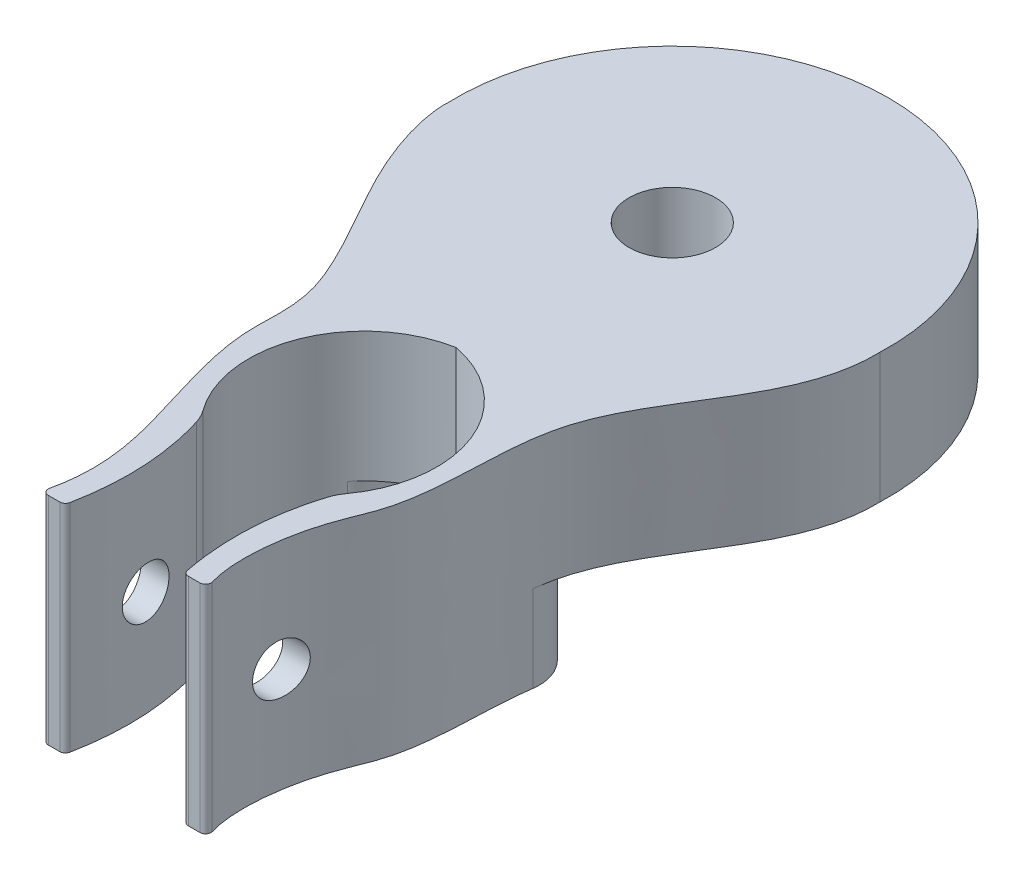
SolidWorks part; units mm, degrees
ref_plane "Front Plane" through (0, 0, 0) normal (0, 0, 1) x (1, 0, 0)
ref_plane "Top Plane" through (0, 0, 0) normal (0, 1, 0) x (1, 0, 0)
ref_plane "Right Plane" through (0, 0, 0) normal (1, 0, 0) x (0, 0, -1)
sketch "Sketch1" plane through (0, 0, 0) normal (0, 1, 0) x (1, 0, 0)
  line L0 (0, 12.7) -> (0, -18.5764) construction
  line L1 (-4.4511, -32.1986) -> (-3.776, -32.1986)
  line L2 (4.4511, -32.1986) -> (3.776, -32.1986)
  arc A0 (-12.6901, -0.502) -> (12.6901, -0.502) centre (0, 0) cw
  circle A1 centre (0, 0) radius 2.54
  arc A2 (-12.6901, -0.502) -> (12.6901, -0.502) centre (0, 0) ccw construction
  arc A3 (0, -12.7) -> (-4.2124, -23.3606) centre (1.256, -19.3588) ccw
  arc A4 (-4.2124, -23.3606) -> (-3.8349, -24.1124) centre (-6.2622, -24.8607) cw
  arc A5 (-3.4519, -31.9324) -> (-3.776, -32.1986) centre (-3.776, -31.8683) cw
  arc A6 (-4.7735, -31.7962) -> (-4.4511, -32.1986) centre (-4.4511, -31.8683) ccw
  arc A7 (4.7735, -31.7962) -> (4.4511, -32.1986) centre (4.4511, -31.8683) cw
  arc A8 (3.4519, -31.9324) -> (3.776, -32.1986) centre (3.776, -31.8683) ccw
  arc A9 (4.2124, -23.3606) -> (3.8349, -24.1124) centre (6.2622, -24.8607) ccw
  arc A10 (0, -12.7) -> (4.2124, -23.3606) centre (-1.256, -19.3588) cw
  spline S0 degree 3 poles (-12.6901, -0.502) (-12.7086, -0.5346) (-12.9445, -3.8187) (-6.4425, -13.8865) (-7.3603, -18.4592) (-5.2739, -24.7591) (-4.156, -29.0329) (-4.7735, -31.7962) knots 0 0 0 0 0.279659 0.433864 0.566787 0.759909 0.988954 0.988954 0.988954 0.988954
  spline S1 degree 3 poles (-3.8349, -24.1124) (-3.6668, -24.6575) (-3.0286, -27.202) (-3.0384, -29.8419) (-3.4519, -31.9324) knots 0.055076 0.055076 0.055076 0.055076 0.252507 0.96957 0.96957 0.96957 0.96957
  spline S2 degree 3 poles (3.8349, -24.1124) (3.6668, -24.6575) (3.0286, -27.202) (3.0384, -29.8419) (3.4519, -31.9324) knots 0.055076 0.055076 0.055076 0.055076 0.252507 0.96957 0.96957 0.96957 0.96957
  spline S3 degree 3 poles (12.6901, -0.502) (12.8342, -5.638) (5.4885, -11.2875) (7.0856, -20.9954) (4.5252, -26.6602) (4.2626, -30.148) (4.7735, -31.7962) knots 0 0 0 0 0.420411 0.703009 0.760968 1 1 1 1
  dimension "D1" = 12.7
  dimension "D2" = 5.08
  dimension "D3" = 2.54
  dimension "D4" = 0.3304
extrude "Boss-Extrude1" add sketch "Sketch1" along normal blind 12.7
ref_plane "Plane1" through (0, 5.08, 0) normal (0, 1, 0) x (1, 0, 0)
sketch "Sketch4" plane through (0, 5.08, 0) normal (0, 1, 0) x (1, 0, 0)
  circle A0 centre (0, 0) radius 12.827
  dimension "D1" = 25.654
extrude "Cut-Extrude4" cut sketch "Sketch4" against normal blind 5.08
fillet "Fillet5" radius 2.54 1 edges at (9.9596, 2.54, 8.0832)
fillet "Fillet6" radius 2.54 1 edges at (-10.2825, 2.54, 7.6682)
fillet "Fillet7" radius 2.54 2 edges at (-0.5103, 2.54, 12.8168) (0.5103, 2.54, 12.8168)
ref_plane "Plane4" through (7.62, 0, 0) normal (1, 0, 0) x (0, 0, -1)
hole_wizard "#4 Clearance Hole3" positions "Sketch12" profile "Sketch11" hole size "#4" standard "ANSI Inch"
sketch "Sketch12" plane through (7.62, 0, 0) normal (1, 0, 0) x (0, 0, -1)
  point P0 (-27.693, 6.1658)
sketch "Sketch11" plane through (7.62, 6.1658, 27.693) normal (0, 1, 0) x (0, 0, -1)
  line L0 (0, 0) -> (0, 20.5645)
  line L1 (0, 20.5645) -> (1.4732, 20.5645)
  line L2 (1.4732, 20.5645) -> (1.4732, 0)
  line L5 (1.4732, 0) -> (0, 0)
  line L11 (0, -6.35) -> (0, 107.95) construction
  dimension "Thru Hole Dia." = 2.9464
  dimension "Thru Hole Depth" = 20.5645
